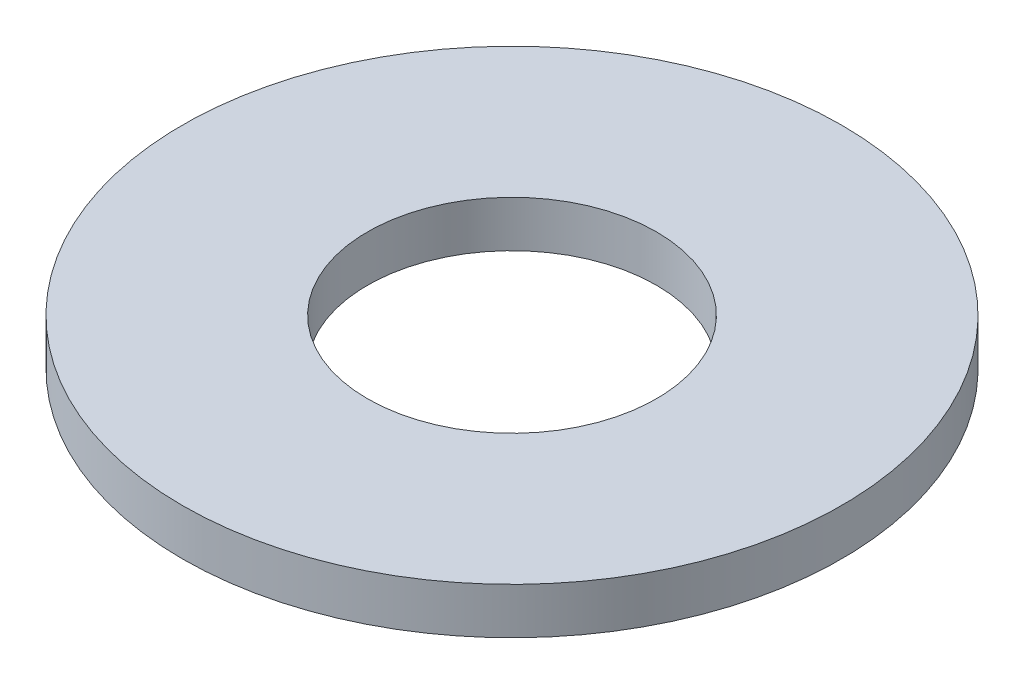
SolidWorks part; units mm, degrees
ref_plane "Front Plane" through (0, 0, 0) normal (0, 0, 1) x (1, 0, 0)
ref_plane "Top Plane" through (0, 0, 0) normal (0, 1, 0) x (1, 0, 0)
ref_plane "Right Plane" through (0, 0, 0) normal (1, 0, 0) x (0, 0, -1)
sketch "Sketch1" plane through (0, 0, 0) normal (0, 1, 0) x (1, 0, 0)
  circle A0 centre (0, 0) radius 7.9375
  circle A1 centre (0, 0) radius 18.0975
  dimension "D1" = 15.875
  dimension "D2" = 10.16
extrude "Boss-Extrude1" add sketch "Sketch1" along normal blind 2.54
